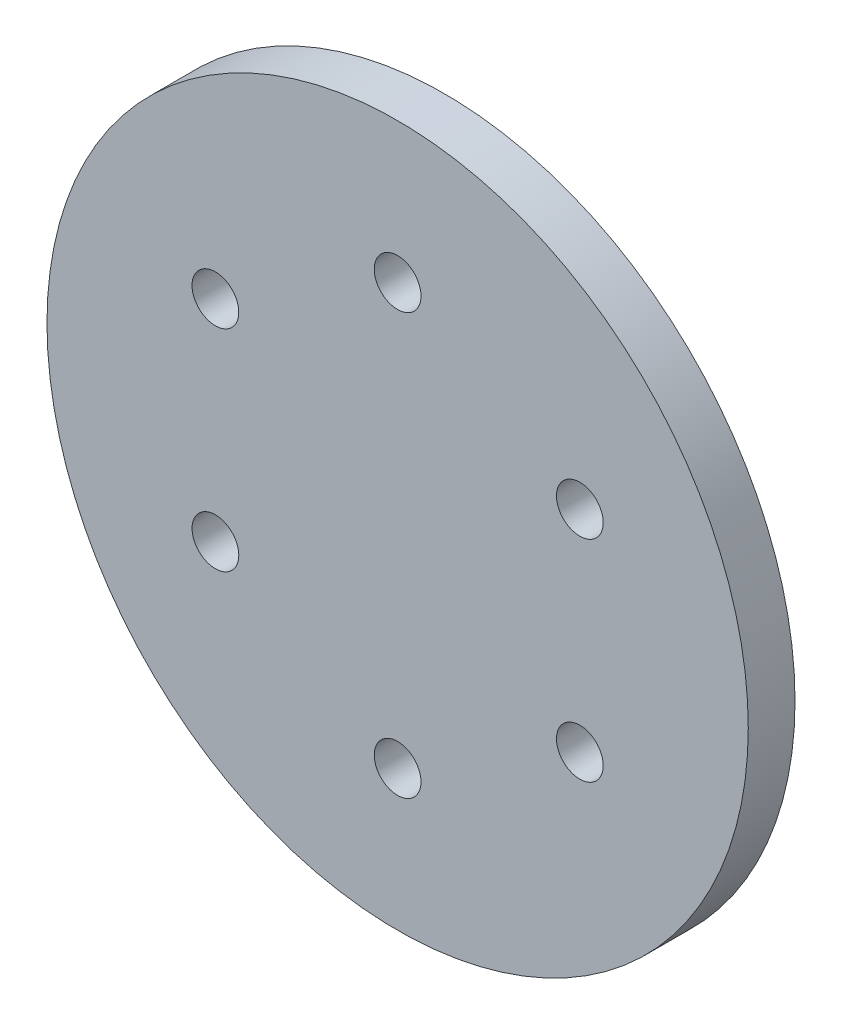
SolidWorks part; units mm, degrees
ref_plane "Front" through (0, 0, 0) normal (0, 0, 1) x (1, 0, 0)
ref_plane "Top" through (0, 0, 0) normal (0, 1, 0) x (1, 0, 0)
ref_plane "Right" through (0, 0, 0) normal (1, 0, 0) x (0, 0, -1)
sketch "Sketch1" plane through (0, 0, 0) normal (0, 0, 1) x (1, 0, 0)
  circle A0 centre (0, 0) radius 75
  dimension "D1" = 150
extrude "Boss-Extrude1" add sketch "Sketch1" along normal blind 10
sketch "Sketch2" plane through (0, 0, 10) normal (0, 0, 1) x (1, 0, 0)
  circle A0 centre (0, 45) radius 5
  dimension "D1" = 10
  dimension "D2" = 45
extrude "Cut-Extrude1" cut sketch "Sketch2" against normal through all
pattern_circular "CirPattern1" count 6 over 360 about axis through (0, 0, 0) along (0, 0, 1) of "Cut-Extrude1"
